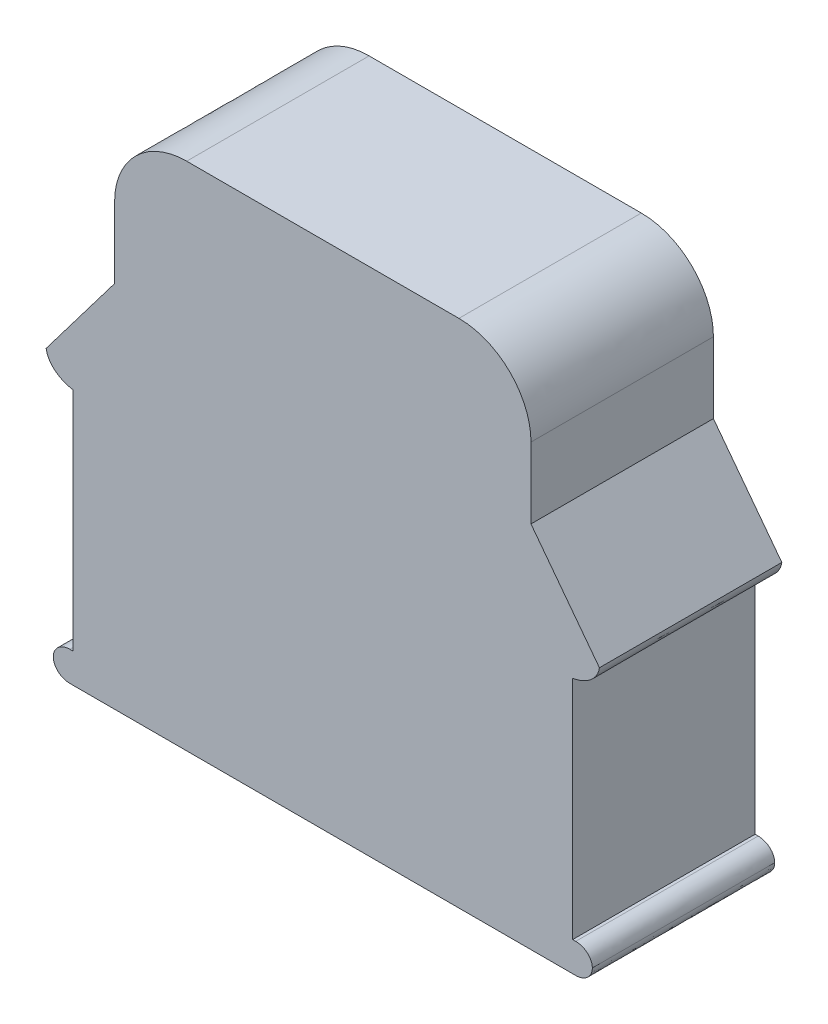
SolidWorks part; units mm, degrees
ref_plane "Front Plane" through (0, 0, 0) normal (0, 0, 1) x (1, 0, 0)
ref_plane "Top Plane" through (0, 0, 0) normal (0, 1, 0) x (1, 0, 0)
ref_plane "Right Plane" through (0, 0, 0) normal (1, 0, 0) x (0, 0, -1)
sketch "Sketch1" plane through (0, 0, 0) normal (0, 0, 1) x (1, 0, 0)
  line L0 (194.7451, -174.2788) -> (194.7452, -174.2788)
  line L1 (125.8297, -174.2788) -> (126.2475, -174.2788)
  line L2 (194.7451, -174.2788) -> (195.1631, -174.2788)
  spline S0 degree 3 poles (195.1631, -174.2788) (196.4153, -174.2788) (197.4364, -175.1895) (197.4364, -176.3062) knots 0.083333 0.083333 0.083333 0.083333 0.125 0.125 0.125 0.125
  spline S1 degree 3 poles (197.4364, -176.3062) (197.4364, -177.4228) (196.4153, -178.3334) (195.1631, -178.3334) knots 0.166667 0.166667 0.166667 0.166667 0.208333 0.208333 0.208333 0.208333
  spline S2 degree 2 poles (195.1631, -178.3334) (195.1631, -178.3334) (125.8297, -178.3334) knots 0.208333 0.208333 0.208333 0.25 0.25 0.25
  spline S3 degree 3 poles (125.8297, -178.3334) (124.5775, -178.3334) (123.5564, -177.4228) (123.5564, -176.3062) knots 0.25 0.25 0.25 0.25 0.291667 0.291667 0.291667 0.291667
  spline S4 degree 3 poles (123.5564, -176.3062) (123.5564, -175.1895) (124.5775, -174.2788) (125.8297, -174.2788) knots 0.333333 0.333333 0.333333 0.333333 0.375 0.375 0.375 0.375
  spline S5 degree 2 poles (126.2475, -174.2788) (126.2475, -174.2788) (126.2475, -143.2605) knots 0.416667 0.416667 0.416667 0.458333 0.458333 0.458333
  spline S6 degree 3 poles (126.2475, -143.2605) (125.3576, -143.126) (124.5591, -142.7924) (123.9366, -142.3237) knots 0.458333 0.458333 0.458333 0.458333 0.5 0.5 0.5 0.5
  spline S7 degree 3 poles (123.9366, -142.3237) (123.1979, -141.7672) (122.703, -141.0203) (122.5837, -140.1821) knots 0.5 0.5 0.5 0.5 0.541667 0.541667 0.541667 0.541667
  spline S8 degree 2 poles (122.5837, -140.1821) (122.5837, -140.1821) (131.9639, -127.8044) knots 0.541667 0.541667 0.541667 0.583333 0.583333 0.583333
  spline S9 degree 2 poles (131.9639, -127.8044) (131.9639, -127.8044) (131.9639, -118.0862) knots 0.583333 0.583333 0.583333 0.625 0.625 0.625
  spline S10 degree 3 poles (131.9639, -118.0862) (131.9639, -112.7263) (136.4092, -108.341) (141.8426, -108.341) knots 0.625 0.625 0.625 0.625 0.666667 0.666667 0.666667 0.666667
  spline S11 degree 2 poles (141.8426, -108.341) (141.8426, -108.341) (179.1499, -108.341) knots 0.666667 0.666667 0.666667 0.708333 0.708333 0.708333
  spline S12 degree 3 poles (179.1499, -108.341) (184.5832, -108.341) (189.0285, -112.7271) (189.0285, -118.0862) knots 0.708333 0.708333 0.708333 0.708333 0.75 0.75 0.75 0.75
  spline S13 degree 2 poles (189.0285, -118.0862) (189.0285, -118.0862) (189.0285, -127.8045) knots 0.75 0.75 0.75 0.791667 0.791667 0.791667
  spline S14 degree 2 poles (189.0285, -127.8045) (189.0285, -127.8045) (198.4088, -140.1821) knots 0.791667 0.791667 0.791667 0.833333 0.833333 0.833333
  spline S15 degree 3 poles (198.4088, -140.1821) (198.2895, -141.0203) (197.7946, -141.7672) (197.0558, -142.3237) knots 0.833333 0.833333 0.833333 0.833333 0.875 0.875 0.875 0.875
  spline S16 degree 3 poles (197.0558, -142.3237) (196.4334, -142.7924) (195.6349, -143.1258) (194.7451, -143.2604) knots 0.875 0.875 0.875 0.875 0.916667 0.916667 0.916667 0.916667
  spline S17 degree 2 poles (194.7451, -143.2604) (194.7451, -143.2604) (194.7451, -174.2788) knots 0.916667 0.916667 0.916667 1 1 1
extrude "Boss-Extrude1" add sketch "Sketch1" along normal blind 25 contours S17 S16 S15 S14 S13 S12 S11 S10 S9 S8 S7 S6 S5 L1 S4 S3 S2 S1 S0 L2 L0
